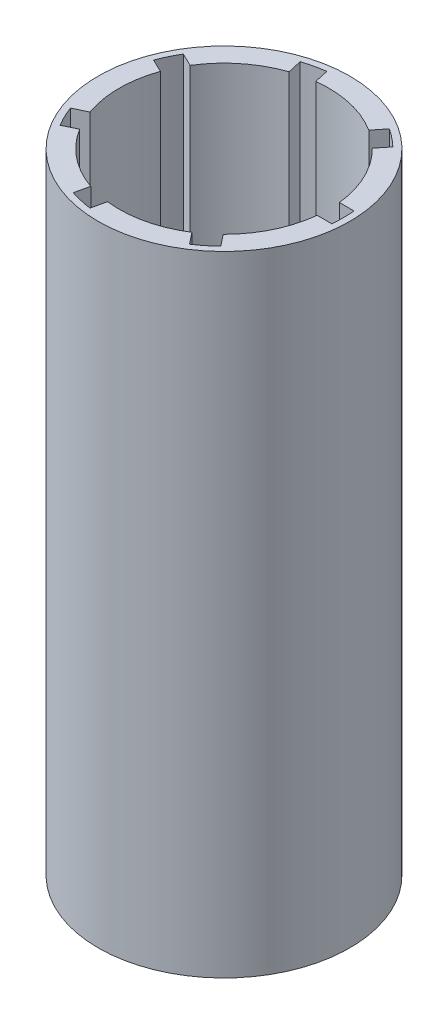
SolidWorks part; units mm, degrees
ref_plane "Plan de face" through (0, 0, 0) normal (0, 0, 1) x (1, 0, 0)
ref_plane "Plan de dessus" through (0, 0, 0) normal (0, 1, 0) x (1, 0, 0)
ref_plane "Plan de droite" through (0, 0, 0) normal (1, 0, 0) x (0, 0, -1)
sketch "Esquisse1" plane through (0, 0, 0) normal (0, 1, 0) x (1, 0, 0)
  line L0 (49.4725, 0) -> (-44.1813, 0) construction
  line L1 (36.8523, -3.4506) -> (32.3163, -3.4506)
  line L3 (36.8523, 3.4506) -> (32.3163, 3.4506)
  line L5 (25.6748, -26.6609) -> (22.8466, -23.1145)
  line L6 (20.2793, -30.9637) -> (17.4511, -27.4173)
  line L8 (-4.8364, -36.6961) -> (-3.827, -32.2739)
  line L9 (-11.5644, -35.1605) -> (-10.5551, -30.7382)
  line L11 (-31.7056, -19.0984) -> (-27.6188, -17.1304)
  line L12 (-34.6999, -12.8808) -> (-30.6131, -10.9127)
  line L14 (-34.6999, 12.8808) -> (-30.6131, 10.9127)
  line L15 (-31.7056, 19.0984) -> (-27.6188, 17.1304)
  line L17 (-11.5644, 35.1605) -> (-10.5551, 30.7382)
  line L18 (-4.8364, 36.6961) -> (-3.827, 32.2739)
  line L20 (20.2793, 30.9637) -> (17.4511, 27.4173)
  line L21 (25.6748, 26.6609) -> (22.8466, 23.1145)
  line L22 (8.7909, -3.4506) -> (8.7909, 3.4506)
  line L23 (2.7833, -9.0244) -> (8.1788, -4.7216)
  line L24 (-5.3202, -7.8026) -> (1.4079, -9.3383)
  line L25 (-9.4174, -0.7054) -> (-6.4232, -6.9231)
  line L26 (-6.4232, 6.9231) -> (-9.4174, 0.7054)
  line L27 (1.4079, 9.3383) -> (-5.3202, 7.8026)
  line L28 (8.1788, 4.7216) -> (2.7833, 9.0244)
  circle A0 centre (0, 0) radius 39
  arc A1 (-27.6188, -17.1304) -> (-10.5551, -30.7382) centre (0, 0) ccw
  arc A2 (36.8523, 3.4506) -> (36.8523, -3.4506) centre (0, 0) cw
  arc A3 (25.6748, -26.6609) -> (20.2793, -30.9637) centre (0, 0) cw
  arc A4 (-4.8364, -36.6961) -> (-11.5644, -35.1605) centre (0, 0) cw
  arc A5 (-31.7056, -19.0984) -> (-34.6999, -12.8808) centre (0, 0) cw
  arc A6 (-34.6999, 12.8808) -> (-31.7056, 19.0984) centre (0, 0) cw
  arc A7 (-11.5644, 35.1605) -> (-4.8364, 36.6961) centre (0, 0) cw
  arc A8 (20.2793, 30.9637) -> (25.6748, 26.6609) centre (0, 0) cw
  arc A9 (-30.6131, 10.9127) -> (-30.6131, -10.9127) centre (0, 0) ccw
  arc A10 (-10.5551, 30.7382) -> (-27.6188, 17.1304) centre (0, 0) ccw
  arc A11 (17.4511, 27.4173) -> (-3.827, 32.2739) centre (0, 0) ccw
  arc A12 (32.3163, 3.4506) -> (22.8466, 23.1145) centre (0, 0) ccw
  arc A13 (22.8466, -23.1145) -> (32.3163, -3.4506) centre (0, 0) ccw
  arc A14 (-3.827, -32.2739) -> (17.4511, -27.4173) centre (0, 0) ccw
  dimension "D1" = 78
  dimension "D2" = 65
extrude "Extrusion1" add sketch "Esquisse1" along normal blind 195
